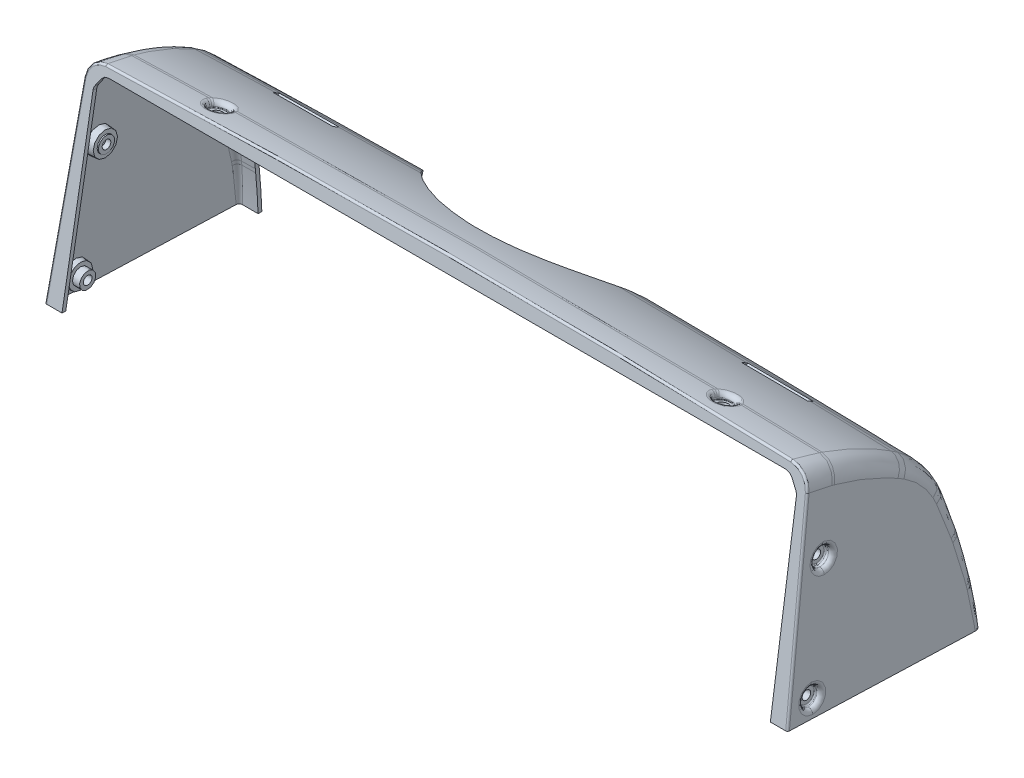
SolidWorks part; units mm, degrees
ref_plane "Front" through (0, 0, 0) normal (0, 0, 1) x (1, 0, 0)
ref_plane "Top" through (0, 0, 0) normal (0, 1, 0) x (1, 0, 0)
ref_plane "Right" through (0, 0, 0) normal (1, 0, 0) x (0, 0, -1)
imported_body "Surface-Imported2"
other "DeleteFace1"
surface "Surface-Offset1" parameters "D1"=0
mirror "Mirror1" about plane through (0, 0, 0) normal (1, 0, 0)
surface "Surface-Knit1"
delete or keep bodies "Body-Delete1" type delete bodies bodies 107
